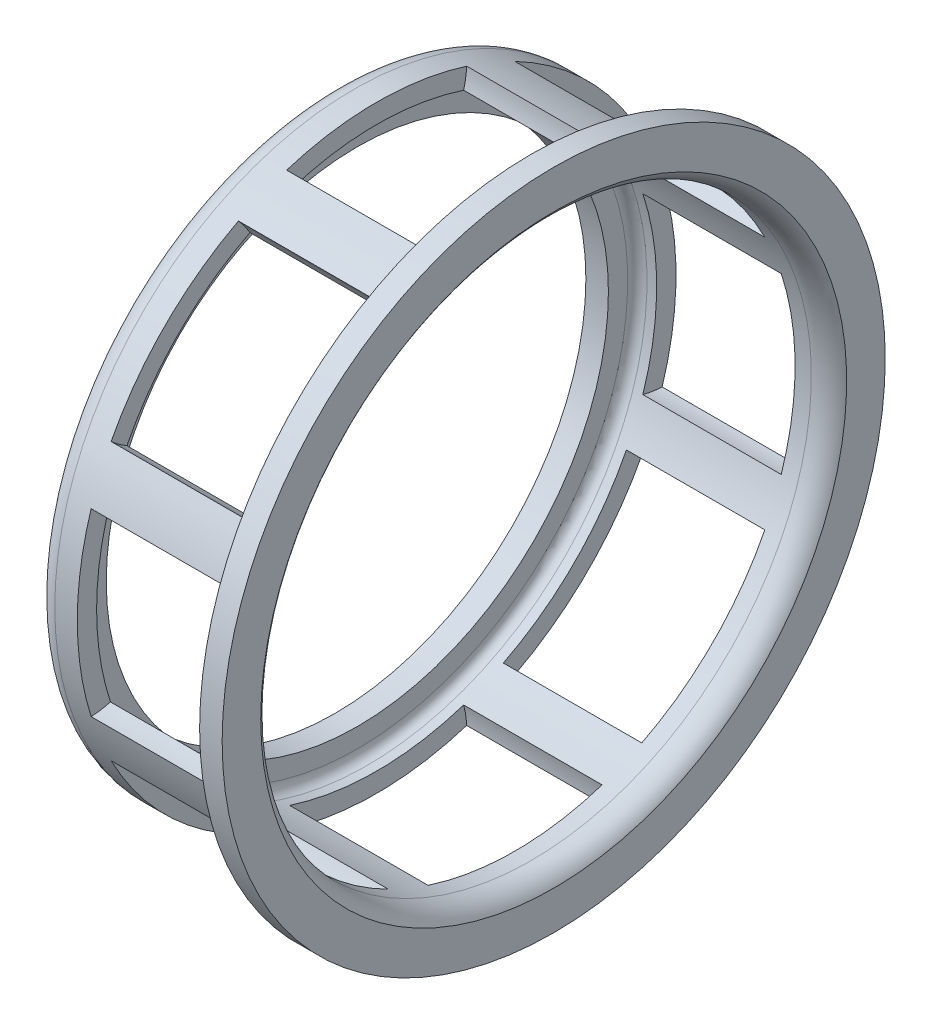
SolidWorks part; units mm, degrees
ref_plane "Plane1" through (0, 0, 0) normal (0, 0, 1) x (1, 0, 0)
ref_plane "Plane2" through (0, 0, 0) normal (0, 1, 0) x (1, 0, 0)
ref_plane "Plane3" through (0, 0, 0) normal (1, 0, 0) x (0, 0, -1)
sketch "Esquisse1" plane through (0, 0, 0) normal (0, 0, 1) x (1, 0, 0)
  line L0 (-3.4, 7.8) -> (-3.4, 8.7)
  line L1 (-3.4, 7.8) -> (-2.7, 7.8)
  line L2 (-2.7, 7.8) -> (-2.7, 8.4)
  line L3 (3.4, 10.3) -> (3.4, 9.1016)
  line L4 (3.4, 10.3) -> (2.7, 10.3)
  line L5 (-5.6, 0) -> (5, 0) construction
  line L7 (-2.8, 9.3) -> (2.5268, 9.3)
  line L8 (-2.4, 8.7) -> (2.7063, 8.7)
  line L10 (2.7, 10.3) -> (2.7, 9.6)
  arc A0 (-2.7, 8.4) -> (-2.4, 8.7) centre (-2.4, 8.4) cw
  arc A1 (-3.4, 8.7) -> (-2.8, 9.3) centre (-2.8, 8.7) cw
  arc A4 (2.7, 9.6) -> (2.5268, 9.3) centre (2.5268, 9.5) cw
  arc A5 (3.4, 9.1016) -> (2.7063, 8.7) centre (2.7063, 9.5) cw
  point P9 (0, 8.6)
  point P20 (0, 9.4)
revolve "Base-Révolution" add sketch "Esquisse1" angle 360 about L5
sketch "Esquisse2" plane through (0, 0, 0) normal (0, 1, 0) x (1, 0, 0)
  line L0 (0, 9) -> (4.4, 9) construction
  line L1 (2.2, 9) -> (-2.1, 9)
  line L2 (2.2, 9) -> (2.2, 11.8)
  line L3 (-2.1, 11.8) -> (2.2, 11.8)
  line L4 (-2.1, 11.8) -> (-2.1, 9)
revolve "Enlever de la matière-Pivoter1" cut sketch "Esquisse2" angle 360 about L0
pattern_circular "Répétition circulaire1" count 8 every 45 about axis through (-5.6, 0, 0) along (1, 0, 0)
